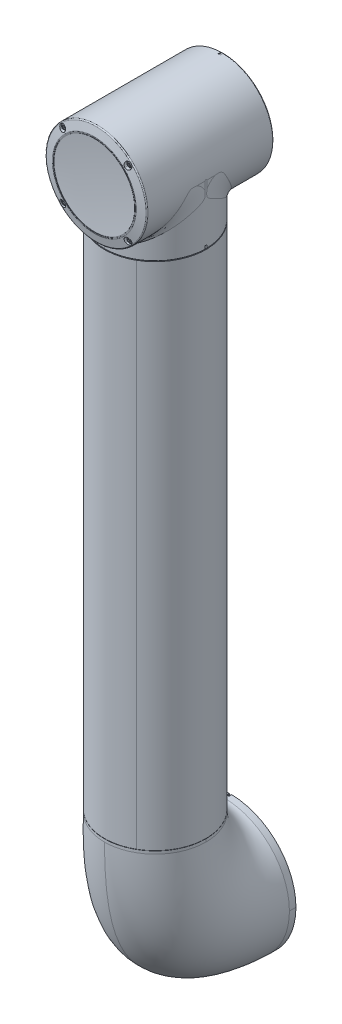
SolidWorks part; units mm, degrees
other "<4.0.07.2008582>-<输入1>"
other "<4.0.07.2008582>-<输入1>"
other "<4.0.07.2008582>-<输入1>"
other "<4.0.07.2008582>-<输入1>"
ref_plane "前视基准面" through (0, 0, 0) normal (0, 0, 1) x (1, 0, 0)
ref_plane "上视基准面" through (0, 0, 0) normal (0, 1, 0) x (1, 0, 0)
ref_plane "右视基准面" through (0, 0, 0) normal (1, 0, 0) x (0, 0, -1)
imported_body "输入1"
imported_body "输入2"
other "删除面1"
inserted part "4.0.07.2008582"
move or copy body "实体-移动/复制2" placed by mates yes
inserted part "4.0.07.20085822"
move or copy body "实体-移动/复制4" placed by mates yes
inserted part "4.0.07.20085823"
move or copy body "实体-移动/复制6" placed by mates yes
inserted part "4.0.07.20085824"
move or copy body "实体-移动/复制8" placed by mates yes
combine bodies "组合1" operation type add bodies to combine 112 113 114 115 116 117
